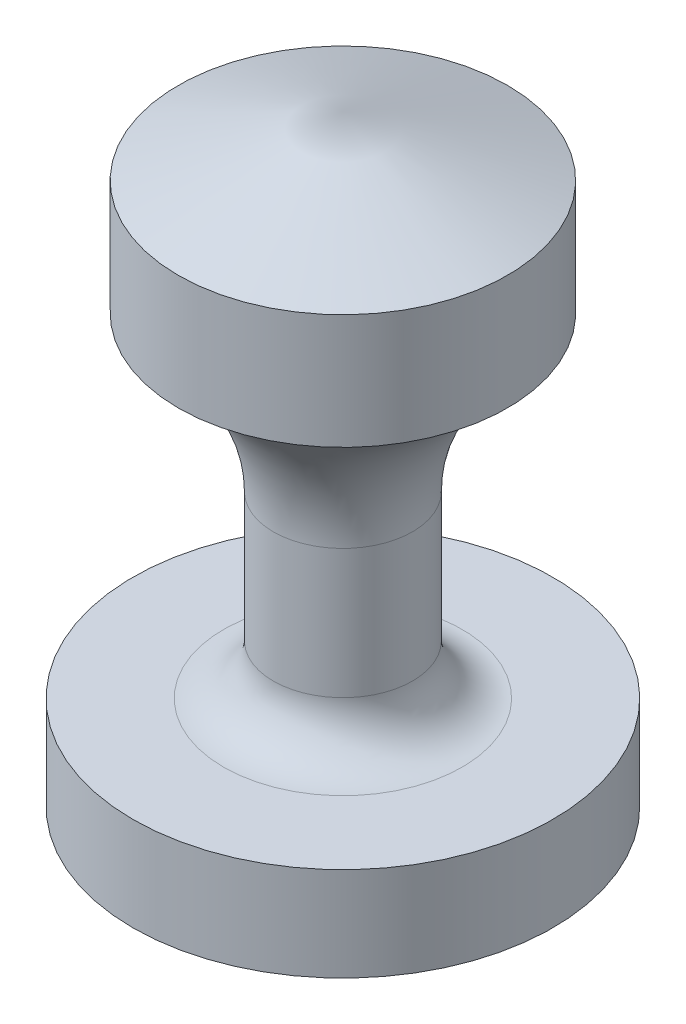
SolidWorks part; units mm, degrees
ref_plane "Front Plane" through (0, 0, 0) normal (0, 0, 1) x (1, 0, 0)
ref_plane "Top Plane" through (0, 0, 0) normal (0, 1, 0) x (1, 0, 0)
ref_plane "Right Plane" through (0, 0, 0) normal (1, 0, 0) x (0, 0, -1)
sketch "Sketch1" plane through (0, 0, 0) normal (0, 0, 1) x (1, 0, 0)
  line L0 (0, 0) -> (33.8559, 0)
  line L1 (33.8559, 0) -> (33.8559, 15.146)
  line L2 (33.8559, 15.146) -> (19.2444, 15.146)
  line L3 (11.2259, 23.1645) -> (11.2259, 44.0126)
  line L4 (26.5501, 68.9591) -> (26.5501, 87.4907)
  line L5 (26.5501, 87.4907) -> (0, 97.1129)
  line L6 (0, 97.1129) -> (0, 0)
  arc A0 (19.2444, 15.146) -> (11.2259, 23.1645) centre (19.2444, 23.1645) cw
  arc A1 (11.2259, 44.0126) -> (26.5501, 68.9591) centre (39.1932, 44.0126) cw
revolve "Revolve1" add sketch "Sketch1" angle 360 about L6
sketch "Sketch2" plane through (0, 0, 0) normal (0, 0, 1) x (1, 0, 0)
  line L0 (26.5501, 87.4907) -> (0, 97.1129)
  line L1 (26.5501, 87.4907) -> (0, 97.1129)
  line L2 (0, 97.1129) -> (-26.5501, 87.4907)
  line L3 (0, 97.1129) -> (-26.5501, 87.4907)
  line L4 (-26.5501, 87.4907) -> (-26.5501, 68.9591)
  line L5 (-26.5501, 87.4907) -> (-26.5501, 68.9591)
  line L6 (26.5501, 68.9591) -> (26.5501, 87.4907)
  line L7 (26.5501, 68.9591) -> (26.5501, 87.4907)
  line L8 (-11.2259, 44.0126) -> (-11.2259, 23.1645)
  line L9 (-11.2259, 44.0126) -> (-11.2259, 23.1645)
  line L10 (11.2259, 23.1645) -> (11.2259, 44.0126)
  line L11 (11.2259, 23.1645) -> (11.2259, 44.0126)
  line L12 (-19.2444, 15.146) -> (-33.8559, 15.146)
  line L13 (-19.2444, 15.146) -> (-33.8559, 15.146)
  line L14 (33.8559, 15.146) -> (19.2444, 15.146)
  line L15 (33.8559, 15.146) -> (19.2444, 15.146)
  line L16 (-33.8559, 15.146) -> (-33.8559, 0)
  line L17 (-33.8559, 15.146) -> (-33.8559, 0)
  line L18 (33.8559, 0) -> (33.8559, 15.146)
  line L19 (33.8559, 0) -> (33.8559, 15.146)
  line L20 (-33.8559, 0) -> (33.8559, 0)
  line L21 (-33.8559, 0) -> (33.8559, 0)
  arc A0 (-11.2259, 44.0126) -> (-26.5501, 68.9591) centre (-39.1932, 44.0126) ccw
  arc A1 (-11.2259, 44.0126) -> (-26.5501, 68.9591) centre (-39.1932, 44.0126) ccw
  arc A2 (26.5501, 68.9591) -> (11.2259, 44.0126) centre (39.1932, 44.0126) ccw
  arc A3 (26.5501, 68.9591) -> (11.2259, 44.0126) centre (39.1932, 44.0126) ccw
  arc A4 (-19.2444, 15.146) -> (-11.2259, 23.1645) centre (-19.2444, 23.1645) ccw
  arc A5 (-19.2444, 15.146) -> (-11.2259, 23.1645) centre (-19.2444, 23.1645) ccw
  arc A6 (11.2259, 23.1645) -> (19.2444, 15.146) centre (19.2444, 23.1645) ccw
  arc A7 (11.2259, 23.1645) -> (19.2444, 15.146) centre (19.2444, 23.1645) ccw
  point P0 (118.2688, 213.3265)
